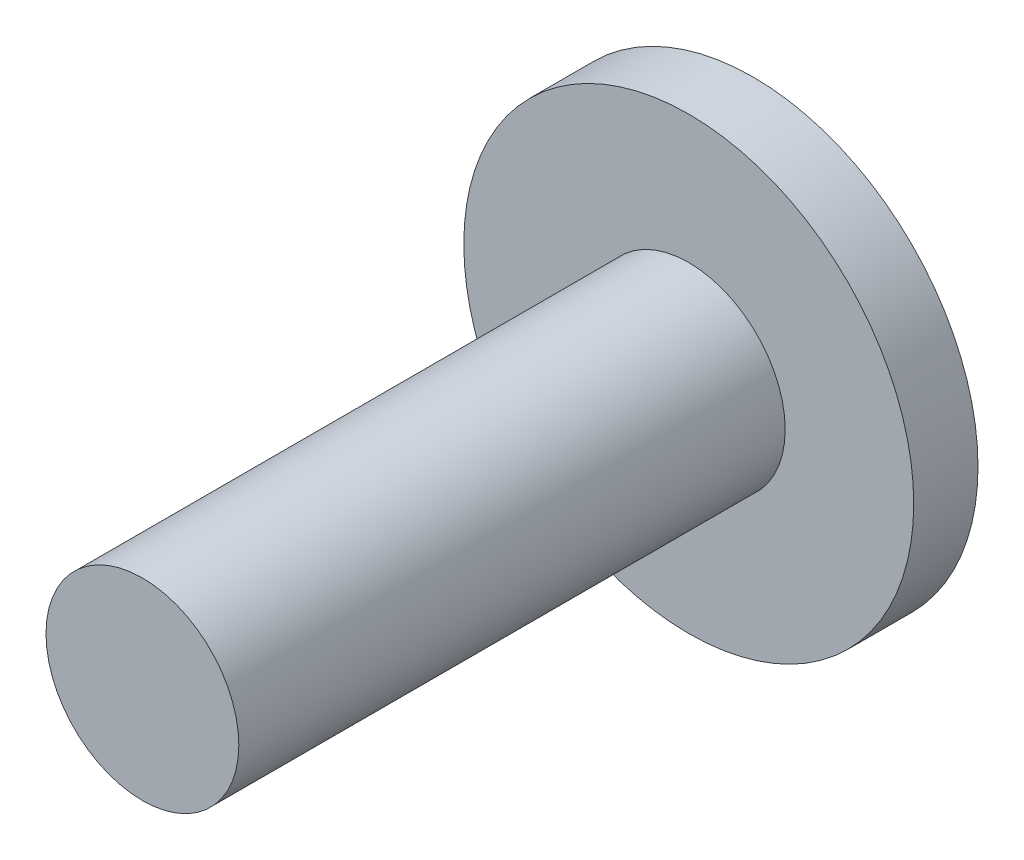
SolidWorks part; units mm, degrees
ref_plane "前视基准面" through (0, 0, 0) normal (0, 0, 1) x (1, 0, 0)
ref_plane "上视基准面" through (0, 0, 0) normal (0, 1, 0) x (1, 0, 0)
ref_plane "右视基准面" through (0, 0, 0) normal (1, 0, 0) x (0, 0, -1)
sketch "草图1" plane through (0, 0, 0) normal (0, 0, 1) x (1, 0, 0)
  circle A0 centre (0, 0) radius 7
  dimension "D1" = 14
extrude "凸台-拉伸1" add sketch "草图1" along normal blind 2
sketch "草图2" plane through (0, 0, 2) normal (0, 0, 1) x (1, 0, 0)
  circle A0 centre (0, 0) radius 3
extrude "凸台-拉伸2" add sketch "草图2" along normal blind 17
